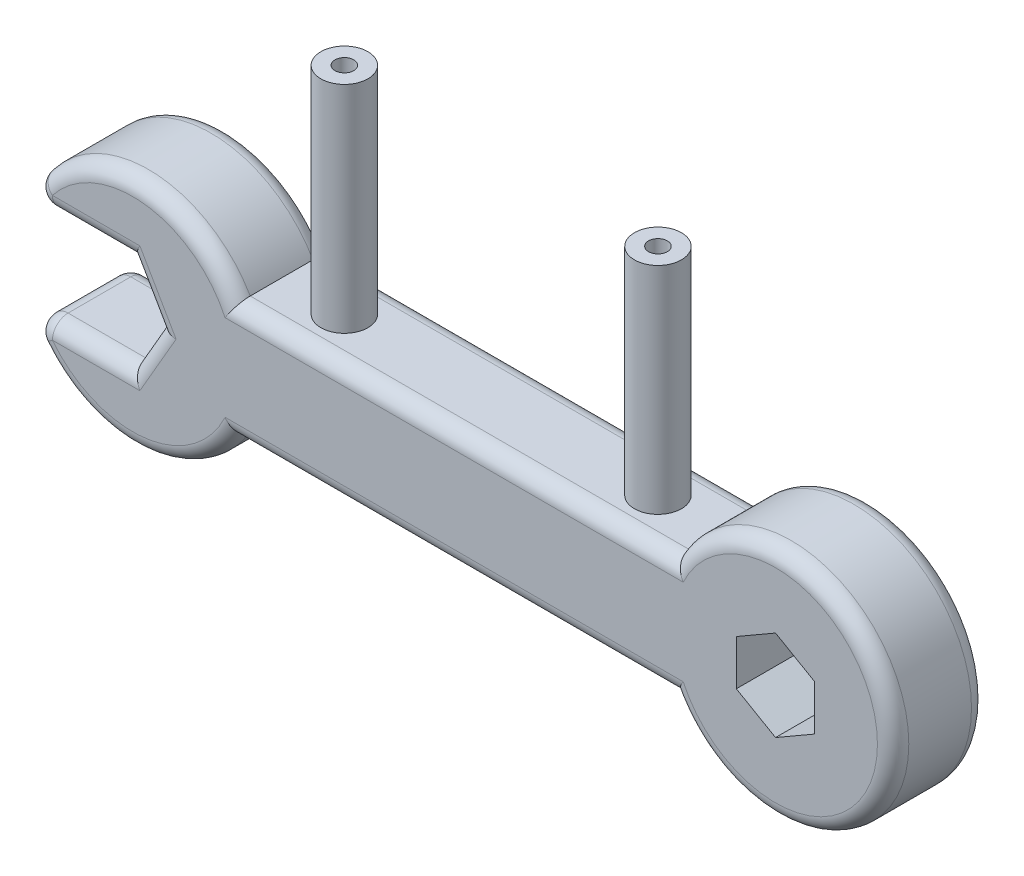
SolidWorks part; units mm, degrees
ref_plane "Front Plane" through (0, 0, 0) normal (0, 0, 1) x (1, 0, 0)
ref_plane "Top Plane" through (0, 0, 0) normal (0, 1, 0) x (1, 0, 0)
ref_plane "Right Plane" through (0, 0, 0) normal (1, 0, 0) x (0, 0, -1)
imported_body "Stock-V1-1"
imported_body "Stock-V1-2"
imported_body "Stock-V1-3"
move or copy body "Body-Move/Copy1" bodies to move or copy 101 102 103 copy no rotation origin (-61.2088, 0, -111.5) rotation axis (0, 1, 0) rotation angle 180
other "Move Face1" parameters "D1"=1
